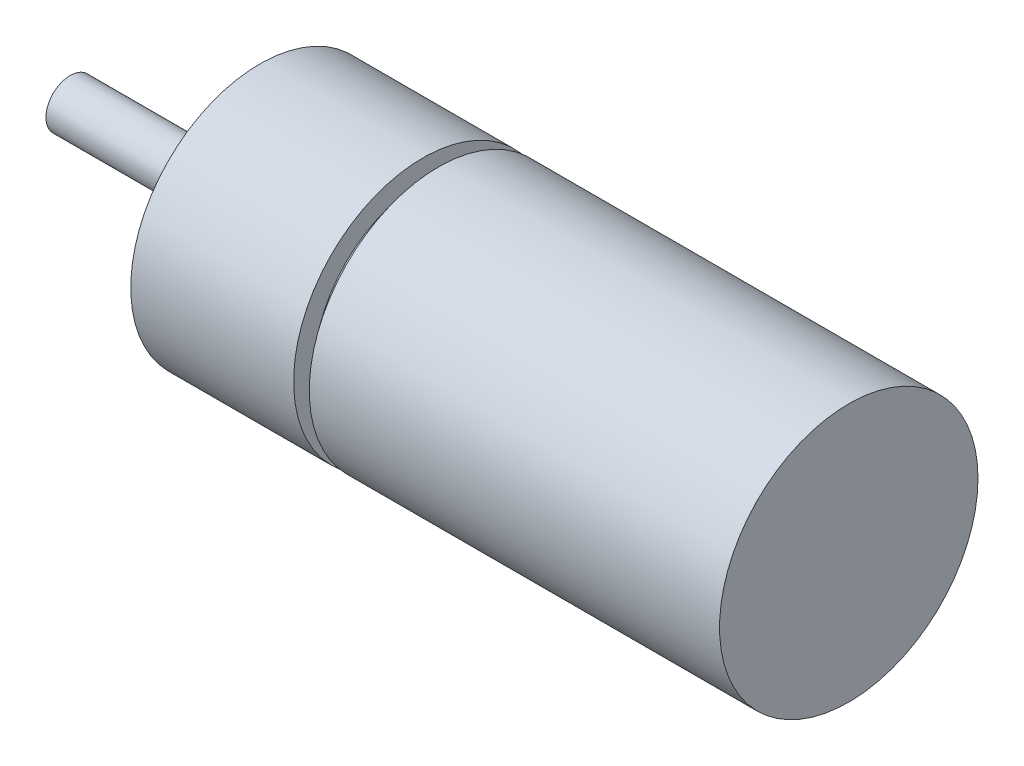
SolidWorks part; units mm, degrees
ref_plane "Front" through (0, 0, 0) normal (0, 0, 1) x (1, 0, 0)
ref_plane "Top" through (0, 0, 0) normal (0, 1, 0) x (1, 0, 0)
ref_plane "Right" through (0, 0, 0) normal (1, 0, 0) x (0, 0, -1)
sketch "Sketch2" plane through (0, 0, 0) normal (0, 0, 1) x (1, 0, 0)
  line L0 (0, 0) -> (-90.1364, 0) construction
  line L1 (0, 0) -> (0, 8)
  line L2 (0, 8) -> (-25.4, 8)
  line L3 (-25.4, 8) -> (-25.4, 7)
  line L4 (-25.4, 7) -> (-26.3674, 6.7469)
  line L5 (-26.3674, 6.7469) -> (-26.3674, 8)
  line L6 (-26.3674, 8) -> (-36.45, 8)
  line L7 (-36.45, 8) -> (-36.45, 3)
  line L8 (-36.45, 3) -> (-38.45, 3)
  line L9 (-38.45, 3) -> (-38.45, 1.5)
  line L10 (-38.45, 1.5) -> (-48.2, 1.5)
  line L11 (-48.2, 1.5) -> (-48.2, 0)
  line L12 (-48.2, 0) -> (0, 0)
  dimension "D1" = 3
  dimension "D2" = 11.75
  dimension "D3" = 1
  dimension "D4" = 1
  dimension "D5" = 16
  dimension "D6" = 25.4
  dimension "D7" = 48.2
  dimension "D8" = 2
  dimension "D9" = 6
revolve "Revolve1" add sketch "Sketch2" angle 360 about L0
hole_wizard "M2x0.4 Tapped Hole1" positions "Sketch4" profile "Sketch3" tap size "M2x0.4" standard "Ansi Metric"
sketch "Sketch4" plane through (-36.45, 0, 0) normal (-1, 0, 0) x (0, 0, 1)
  line L0 (0, 0) -> (6.5865, 0) construction
  line L2 (0, 0) -> (0, 5) construction
  point P0 (0, 5)
  point P12 (0, -5)
  dimension "D1" = 10
sketch "Sketch3" plane through (-36.45, 5, 0) normal (0, 1, 0) x (0, 0, 1)
  line L0 (0, 0) -> (0, 5.8147)
  line L1 (0, 5.8147) -> (0.8, 5.334)
  line L2 (0.8, 5.334) -> (0.8, 0)
  line L5 (0.8, 0) -> (0, 0)
  line L10 (0, 5.8147) -> (-0.8, 5.334) construction
  line L11 (0, -6.35) -> (0, 107.95) construction
  dimension "Tap Drill Dia." = 1.6
  dimension "Tap Drill Depth" = 5.334
  dimension "Drill Angle" = 118
